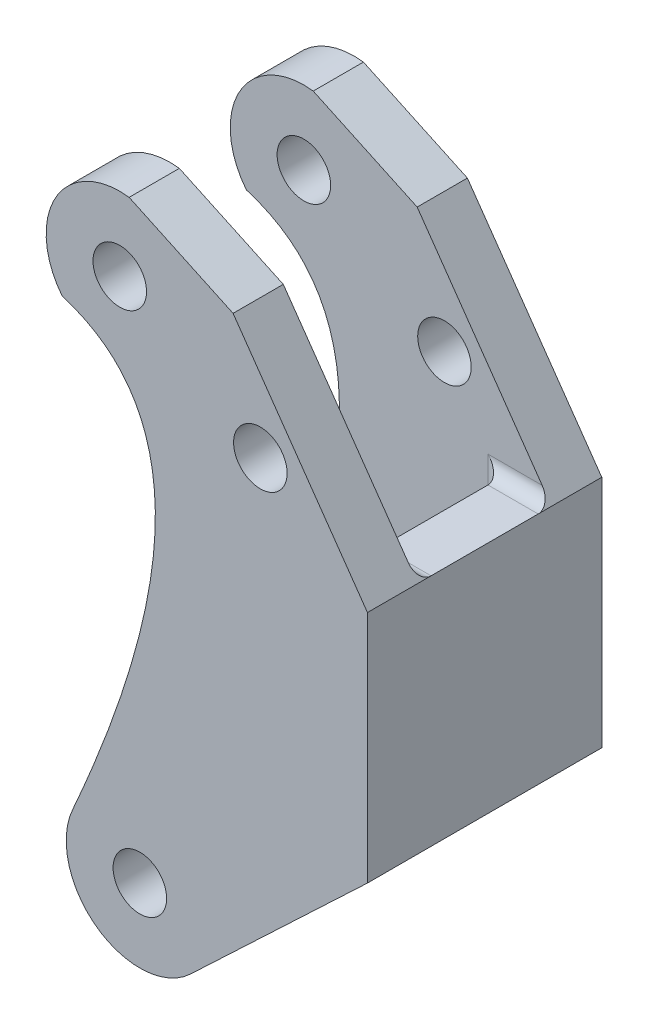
SolidWorks part; units mm, degrees
ref_plane "Plan de face" through (0, 0, 0) normal (0, 0, 1) x (1, 0, 0)
ref_plane "Plan de dessus" through (0, 0, 0) normal (0, 1, 0) x (1, 0, 0)
ref_plane "Plan de droite" through (0, 0, 0) normal (1, 0, 0) x (0, 0, -1)
sketch "Esquisse1" plane through (0, 0, 0) normal (0, 0, 1) x (1, 0, 0)
  line L0 (0, 0) -> (0, 35)
  line L1 (0, 35) -> (-20.0752, 63.6703)
  line L2 (0, 0) -> (-26.4441, -24.9942)
  line L3 (-34, 16.6729) -> (-34, -64.9961) construction
  line L5 (-20.0752, 63.6703) -> (-35.6026, 70.9109)
  line L6 (-37, 101.1678) -> (-37, 38.7151) construction
  arc A0 (-44.0335, -12.4912) -> (-26.4441, -24.9942) centre (-34, -17) ccw
  arc A1 (-35.6026, 70.9109) -> (-45.5921, 53.1316) centre (-37, 60) ccw
  parabola Q0
  point P24 (-44.0335, -12.4912)
  dimension "D7" = 22
  dimension "D10" = 22
  dimension "D1" = 35
  dimension "D2" = 35
  dimension "D3" = 35
  dimension "D4" = 37
  dimension "D5" = 34
  dimension "D6" = 17
  dimension "D8" = 30
  dimension "D9" = 77
extrude "Extrusion1" add sketch "Esquisse1" along normal blind 35
sketch "Esquisse3" plane through (0, 0, 0) normal (1, 0, 0) x (0, 0, -1)
  line L0 (-35, 35) -> (0, 35) construction
  line L1 (-27.5, 35) -> (-7.5, 35)
  line L2 (-27.5, 35) -> (-27.5, 74.7723)
  line L3 (-27.5, 74.7723) -> (-7.5, 74.7723)
  line L4 (-7.5, 35) -> (-7.5, 74.7723)
  line L5 (-35, 35) -> (-35, 63.6703) construction
  line L7 (-35, 0) -> (0, 0) construction
  line L8 (-27.5, 0) -> (-7.5, 0)
  line L9 (-27.5, 0) -> (-27.5, -28.5959)
  line L10 (-27.5, -28.5959) -> (-7.5, -28.5959)
  line L11 (-7.5, 0) -> (-7.5, -28.5959)
  dimension "D1" = 20
  dimension "D2" = 7.5
extrude "Enlèv. mat.-Extru.1" cut sketch "Esquisse3" against normal through all
sketch "Esquisse4" plane through (0, 0, 0) normal (0, -1, 0) x (1, 0, 0)
  line L0 (-45, 27.5) -> (-26.4441, 27.5) construction
  line L1 (-41.2347, 27.5) -> (-7.5, 27.5)
  line L2 (-41.2347, 27.5) -> (-41.2347, 7.5)
  line L3 (-41.2347, 7.5) -> (-7.5, 7.5)
  line L4 (-7.5, 27.5) -> (-7.5, 7.5)
  line L5 (-38.8976, 7.5) -> (0, 7.5) construction
  line L6 (0, 7.5) -> (0, 27.5) construction
  dimension "D1" = 7.5
extrude "Enlèv. mat.-Extru.2" cut sketch "Esquisse4" against normal through all
sketch "Esquisse5" plane through (0, 0, 0) normal (0, 0, -1) x (-1, 0, 0)
  circle A0 centre (37, 60) radius 4
  circle A1 centre (34, -17) radius 4
  arc A3 (45.5921, 53.1316) -> (35.6026, 70.9109) centre (37, 60) ccw construction
  dimension "D1" = 8
  dimension "D2" = 8
extrude "Enlèv. mat.-Extru.3" cut sketch "Esquisse5" against normal through all
fillet "Congé1" radius 2 6 edges at (-3.75, 35, 27.5) (-7.5, 17.5, 27.5) (-3.75, 0, 27.5) (-3.75, 0, 7.5) (-3.75, 35, 7.5) (-7.5, 17.5, 7.5)
sketch "Esquisse6" plane through (0, 0, 35) normal (0, 0, 1) x (1, 0, 0)
  line L0 (-16, 70.5969) -> (-16, -18.8141) construction
  line L1 (0, 0) -> (0, 35) construction
  line L2 (-29.8312, 47) -> (-0.8914, 47) construction
  circle A0 centre (-16, 47) radius 4
  dimension "D3" = 8
  dimension "D1" = 16
  dimension "D2" = 12
extrude "Enlèv. mat.-Extru.4" cut sketch "Esquisse6" against normal through all
ref_plane "Plan2" through (-37, 0, 0) normal (1, 0, 0) x (0, 0, -1)
sketch "Esquisse7" plane through (0, 0, 0) normal (0.6869, -0.7267, 0) x (0.7267, 0.6869, 0)
  line L0 (-36.3868, 7.5) -> (-36.3868, 0) construction
  circle A0 centre (-36.3868, 3.75) radius 2.5
extrude "Extrusion2" cut sketch "Esquisse7" against normal up to next
